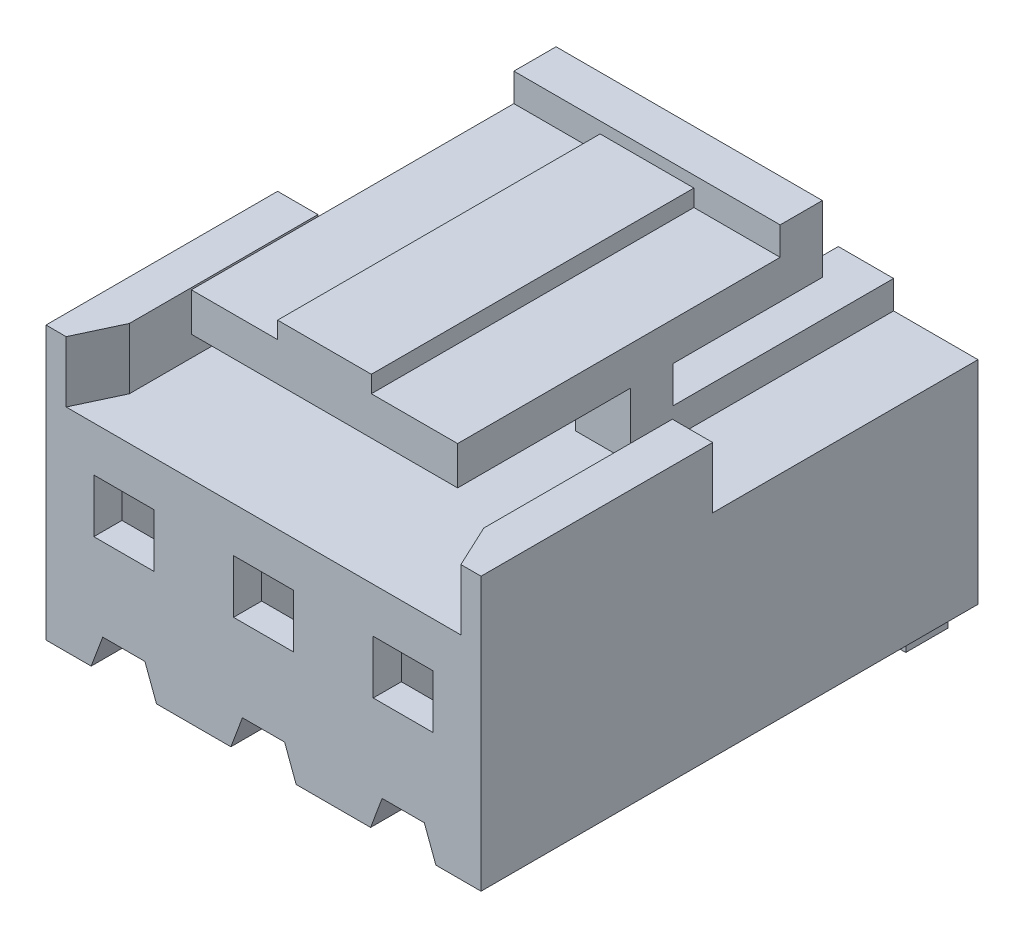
SolidWorks part; units mm, degrees
ref_plane "Front Plane" through (0, 0, 0) normal (0, 0, 1) x (1, 0, 0)
ref_plane "Top Plane" through (0, 0, 0) normal (0, 1, 0) x (1, 0, 0)
ref_plane "Right Plane" through (0, 0, 0) normal (1, 0, 0) x (0, 0, -1)
sketch "Sketch1" plane through (0, 0, 0) normal (0, 1, 0) x (1, 0, 0)
  line L1 (0, 0) -> (11.7856, 0)
  line L2 (0, 0) -> (0, 13.462)
  line L3 (0, 13.462) -> (11.7856, 13.462)
  line L4 (11.7856, 0) -> (11.7856, 13.462)
  dimension "D1" = 11.7856
  dimension "D2" = 13.462
extrude "Extrude1" add sketch "Sketch1" along normal blind 5.7404
sketch "Sketch2" plane through (0, 5.7404, 0) normal (0, 1, 0) x (1, 0, 0)
  line L0 (5.8928, 13.462) -> (5.8928, 0) construction
  line L1 (11.7856, 13.462) -> (0, 13.462) construction
  line L2 (0, 0) -> (11.7856, 0) construction
  line L3 (11.7856, 0) -> (11.7856, 6.2738)
  line L4 (11.7856, 0) -> (11.7856, 13.462) construction
  line L5 (11.7856, 6.2738) -> (10.6934, 6.2738)
  line L6 (10.6934, 6.2738) -> (10.6934, 1.1663)
  line L7 (10.6934, 1.1663) -> (11.2395, 0)
  line L8 (11.2395, 0) -> (11.7856, 0)
  line L9 (11.2395, 6.2738) -> (11.2395, 0.5658) construction
  line L10 (0.5461, 6.2738) -> (0.5461, 0.5658) construction
  line L11 (0.5461, 0) -> (0, 0)
  line L12 (1.0922, 1.1663) -> (0.5461, 0)
  line L13 (1.0922, 6.2738) -> (1.0922, 1.1663)
  line L14 (0, 6.2738) -> (1.0922, 6.2738)
  line L15 (0, 0) -> (0, 6.2738)
  dimension "D1" = 6.2738
  dimension "D2" = 1.0922
  dimension "D3" = 0.5461
  dimension "D4" = 1.2879
extrude "Extrude2" add sketch "Sketch2" along normal blind 1.651
sketch "Sketch3" plane through (0, 5.7404, 0) normal (0, 1, 0) x (1, 0, 0)
  line L0 (5.8928, 13.462) -> (5.8928, 0) construction
  line L1 (11.7856, 13.462) -> (0, 13.462) construction
  line L2 (0.5461, 0) -> (11.2395, 0) construction
  line L3 (5.8928, 6.731) -> (11.7856, 6.731) construction
  line L4 (11.7856, 6.2738) -> (11.7856, 13.462) construction
  line L5 (5.8928, 6.731) -> (0, 6.731) construction
  line L6 (0, 13.462) -> (0, 6.2738) construction
  line L7 (3.7846, 6.3393) -> (2.286, 6.3393)
  line L8 (8.001, 13.462) -> (9.4996, 13.462)
  line L9 (8.001, 13.462) -> (8.001, 6.3393)
  line L10 (2.286, 13.462) -> (2.286, 6.3393)
  line L11 (9.4996, 13.462) -> (9.4996, 6.3393)
  line L12 (3.7846, 13.462) -> (3.7846, 6.3393)
  line L13 (3.7846, 13.462) -> (2.286, 13.462)
  line L14 (8.001, 6.3393) -> (9.4996, 6.3393)
  dimension "D1" = 7.1227
  dimension "D2" = 1.4986
  dimension "D3" = 3.7846
extrude "Extrude3" add sketch "Sketch3" along normal blind 0.762
sketch "Sketch5" plane through (0, 6.5024, 0) normal (0, 1, 0) x (1, 0, 0)
  line L0 (3.7846, 6.3393) -> (3.7846, 13.462) construction
  line L1 (2.286, 6.3393) -> (3.7846, 6.3393)
  line L2 (2.286, 6.3393) -> (2.286, 7.4823)
  line L3 (2.286, 7.4823) -> (3.7846, 7.4823)
  line L4 (3.7846, 6.3393) -> (3.7846, 7.4823)
  line L5 (5.8928, 13.462) -> (5.8928, 0) construction
  line L6 (8.001, 13.462) -> (3.7846, 13.462) construction
  line L7 (0.5461, 0) -> (11.2395, 0) construction
  line L8 (8.001, 6.3393) -> (8.001, 7.4823)
  line L9 (9.4996, 7.4823) -> (8.001, 7.4823)
  line L10 (9.4996, 6.3393) -> (9.4996, 7.4823)
  line L11 (9.4996, 6.3393) -> (8.001, 6.3393)
  dimension "D1" = 1.143
extrude "Extrude5" add sketch "Sketch5" along normal blind 0.9906
sketch "Sketch6" plane through (0, 7.493, 0) normal (0, 1, 0) x (1, 0, 0)
  line L0 (2.286, 13.462) -> (2.286, 6.3393) construction
  line L1 (2.286, 11.5316) -> (9.4996, 11.5316)
  line L2 (2.286, 11.5316) -> (2.286, 1.651)
  line L3 (2.286, 1.651) -> (9.4996, 1.651)
  line L4 (9.4996, 11.5316) -> (9.4996, 1.651)
  line L5 (8.001, 13.462) -> (3.7846, 13.462) construction
  dimension "D1" = 1.9304
  dimension "D2" = 7.2136
  dimension "D3" = 9.8806
extrude "Extrude6" add sketch "Sketch6" along normal blind 1.0414
sketch "Sketch7" plane through (0, 8.5344, 0) normal (0, 1, 0) x (1, 0, 0)
  line L0 (5.8928, 11.5316) -> (5.8928, 1.651) construction
  line L1 (9.4996, 11.5316) -> (2.286, 11.5316) construction
  line L2 (2.286, 1.651) -> (9.4996, 1.651) construction
  line L4 (4.6228, 11.5316) -> (7.1628, 11.5316)
  line L5 (4.6228, 11.5316) -> (4.6228, 1.651)
  line L6 (4.6228, 1.651) -> (7.1628, 1.651)
  line L7 (7.1628, 11.5316) -> (7.1628, 1.651)
  line L8 (2.286, 11.5316) -> (2.286, 1.651) construction
  dimension "D1" = 2.54
  dimension "D2" = 1.27
  dimension "D3" = 2.3368
extrude "Extrude7" add sketch "Sketch7" along normal blind 0.4572
sketch "Sketch8" plane through (0, 8.5344, 0) normal (0, 1, 0) x (1, 0, 0)
  line L0 (9.4996, 1.651) -> (9.4996, 11.5316) construction
  line L1 (2.286, 11.5316) -> (9.4996, 11.5316)
  line L2 (2.286, 11.5316) -> (2.286, 10.3886)
  line L3 (2.286, 10.3886) -> (9.4996, 10.3886)
  line L4 (9.4996, 11.5316) -> (9.4996, 10.3886)
  dimension "D1" = 1.143
extrude "Extrude8" add sketch "Sketch8" along normal blind 0.762
sketch "Sketch10" plane through (0, 0, 0) normal (0, 0, 1) x (1, 0, 0)
  line L0 (5.8928, 5.7404) -> (5.8928, 0) construction
  line L1 (1.2954, 4.5212) -> (2.921, 4.5212)
  line L2 (1.2954, 4.5212) -> (1.2954, 3.0734)
  line L3 (1.2954, 3.0734) -> (2.921, 3.0734)
  line L4 (2.921, 4.5212) -> (2.921, 3.0734)
  line L5 (0.5461, 5.7404) -> (11.2395, 5.7404) construction
  line L6 (0, 0) -> (11.7856, 0) construction
  line L7 (5.3213, 0.8382) -> (6.4643, 0.8382)
  line L8 (2.1082, 3.0734) -> (2.1082, 0.8382) construction
  line L9 (5.3213, 0.8382) -> (5.0086, 0)
  line L10 (2.286, 5.7404) -> (3.7846, 5.7404) construction
  line L11 (5.08, 4.5212) -> (6.7056, 4.5212)
  line L12 (6.7056, 4.5212) -> (6.7056, 3.0734)
  line L13 (5.08, 4.5212) -> (5.08, 3.0734)
  line L14 (5.08, 3.0734) -> (6.7056, 3.0734)
  line L15 (8.8646, 4.5212) -> (8.8646, 3.0734)
  line L16 (10.4902, 3.0734) -> (8.8646, 3.0734)
  line L17 (10.4902, 4.5212) -> (10.4902, 3.0734)
  line L18 (10.4902, 4.5212) -> (8.8646, 4.5212)
  line L19 (6.4643, 0.8382) -> (6.777, 0)
  line L20 (5.0086, 0) -> (6.777, 0)
  line L21 (10.5616, 0) -> (8.7932, 0)
  line L22 (10.2489, 0.8382) -> (9.1059, 0.8382)
  line L23 (9.1059, 0.8382) -> (8.7932, 0)
  line L24 (10.2489, 0.8382) -> (10.5616, 0)
  line L25 (0, 7.3914) -> (0, 0) construction
  line L28 (1.5367, 0.8382) -> (1.224, 0)
  line L29 (2.6797, 0.8382) -> (2.9924, 0)
  line L30 (1.5367, 0.8382) -> (2.6797, 0.8382)
  line L31 (1.224, 0) -> (2.9924, 0)
  dimension "D1" = 1.6256
  dimension "D2" = 1.4478
  dimension "D3" = 1.2192
  dimension "D4" = 2.159
  dimension "D5" = 1.6256
  dimension "D6" = 0.8128
  dimension "D7" = 1.4478
  dimension "D8" = 1.2192
  dimension "D9" = 1.143
  dimension "D10" = 2.2352
  dimension "D11" = 1.7685
  dimension "D12" = 0.8946
  dimension "D13" = 0.8946
  dimension "D14" = 1.224
  dimension "D15" = 0.8842
extrude "Extrude9" cut sketch "Sketch10" against normal blind 6.35
sketch "Sketch12" plane through (0, 0, -13.462) normal (0, 0, -1) x (-1, 0, 0)
  line L0 (-5.8928, 0) -> (-5.8928, 5.7404) construction
  line L1 (-7.493, 5.0292) -> (-4.2926, 5.0292)
  line L2 (-7.493, 5.0292) -> (-7.493, 0.8128)
  line L3 (-7.493, 0.8128) -> (-4.2926, 0.8128)
  line L4 (-4.2926, 5.0292) -> (-4.2926, 0.8128)
  line L7 (-11.7856, 0) -> (0, 0) construction
  line L8 (-8.001, 5.7404) -> (-3.7846, 5.7404) construction
  line L9 (-11.7856, 5.7404) -> (-9.4996, 5.7404) construction
  line L10 (-11.2522, 5.0292) -> (-8.0518, 5.0292)
  line L11 (-11.2522, 5.0292) -> (-11.2522, 0.8128)
  line L12 (-11.2522, 0.8128) -> (-8.0518, 0.8128)
  line L13 (-8.0518, 5.0292) -> (-8.0518, 0.8128)
  line L14 (-3.7338, 5.0292) -> (-3.7338, 0.8128)
  line L15 (-0.5334, 0.8128) -> (-3.7338, 0.8128)
  line L16 (-0.5334, 5.0292) -> (-0.5334, 0.8128)
  line L17 (-0.5334, 5.0292) -> (-3.7338, 5.0292)
  dimension "D1" = 3.2004
  dimension "D2" = 4.2164
  dimension "D3" = 0.7112
  dimension "D4" = 1.6002
  dimension "D5" = 3.2004
  dimension "D6" = 4.2164
  dimension "D7" = 0.5588
  dimension "D8" = 0.7112
extrude "Extrude10" cut sketch "Sketch12" against normal blind 12.7
sketch "Sketch13" plane through (0, 0, 0) normal (0, -1, 0) x (1, 0, 0)
  line L0 (11.7856, -13.462) -> (0, -13.462) construction
  line L1 (0.8128, -13.462) -> (10.9728, -13.462)
  line L2 (0.8128, -13.462) -> (0.8128, -12.319)
  line L3 (0.8128, -12.319) -> (10.9728, -12.319)
  line L4 (10.9728, -13.462) -> (10.9728, -12.319)
  line L5 (0, -13.462) -> (0, 0) construction
  line L6 (11.7856, 0) -> (11.7856, -13.462) construction
  dimension "D1" = 1.143
  dimension "D2" = 0.8128
  dimension "D3" = 0.8128
extrude "Extrude11" add sketch "Sketch13" along normal blind 0.9652
